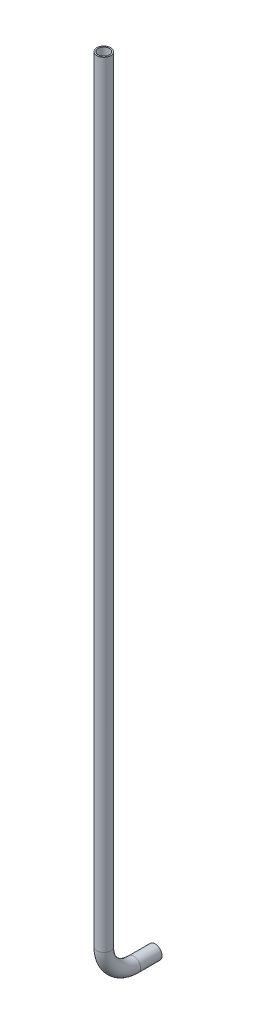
SolidWorks part; units mm, degrees
ref_plane "Front Plane" through (0, 0, 0) normal (0, 0, 1) x (1, 0, 0)
ref_plane "Top Plane" through (0, 0, 0) normal (0, 1, 0) x (1, 0, 0)
ref_plane "Right Plane" through (0, 0, 0) normal (1, 0, 0) x (0, 0, -1)
sketch "Sketch1" plane through (0, 0, 0) normal (1, 0, 0) x (0, 0, -1)
  line L1 (0, 0) -> (-14.732, 0)
  line L2 (-35.3695, 20.6375) -> (-35.3695, 554.0375)
  arc A1 (-14.732, 0) -> (-35.3695, 20.6375) centre (-14.732, 20.6375) cw
  dimension "D1" = 20.6375
  dimension "D2" = 533.4
  dimension "D3" = 14.732
sketch "Sketch2" plane through (0, 0, 0) normal (0, 0, 1) x (1, 0, 0)
  circle A0 centre (0, 0) radius 3.8735
  circle A1 centre (0, 0) radius 4.7625
  dimension "D1" = 0.889
  dimension "D2" = 9.525
sweep "Sweep1" add profiles "Sketch2" path "Sketch1"
